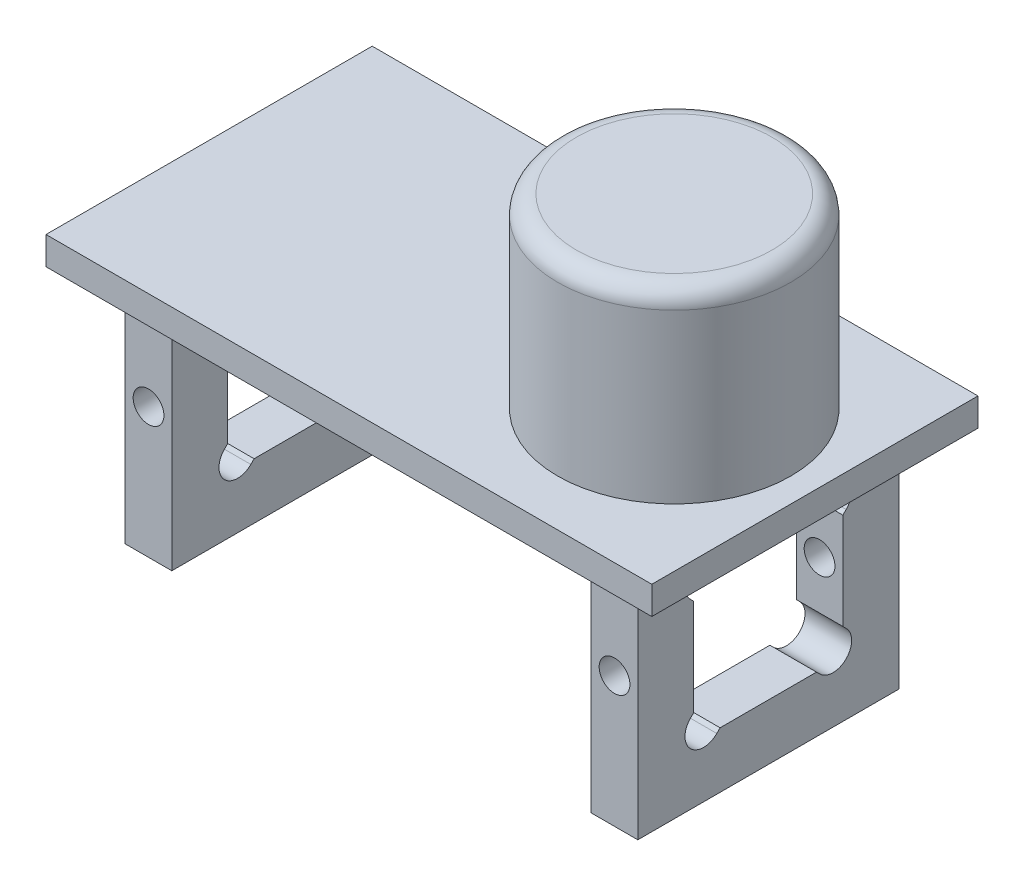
SolidWorks part; units mm, degrees
ref_plane "Plan de face" through (0, 0, 0) normal (0, 0, 1) x (1, 0, 0)
ref_plane "Plan de dessus" through (0, 0, 0) normal (0, 1, 0) x (1, 0, 0)
ref_plane "Plan de droite" through (0, 0, 0) normal (1, 0, 0) x (0, 0, -1)
sketch "Esquisse1" plane through (0, 0, 0) normal (0, 0, 1) x (1, 0, 0)
  line L1 (0, 0) -> (65, 0)
  line L2 (0, 0) -> (0, 3)
  line L3 (0, 3) -> (65, 3)
  line L4 (65, 0) -> (65, 3)
  dimension "D1" = 65
  dimension "D2" = 3
extrude "Boss.-Extru.1" add sketch "Esquisse1" along normal mid plane 35
sketch "Esquisse2" plane through (0, 3, 0) normal (0, 1, 0) x (1, 0, 0)
  circle A0 centre (49.9073, 0) radius 12.5
  dimension "D1" = 25
extrude "Boss.-Extru.2" add sketch "Esquisse2" along normal blind 20
sketch "Esquisse4" plane through (0, 0, 0) normal (-1, 0, 0) x (0, 0, 1)
  line L0 (17.5, 0) -> (-17.5, 0) construction
  line L1 (-8, -3) -> (8, -3) construction
  line L2 (-8, -3) -> (-8, -19) construction
  line L3 (-8, -19) -> (8, -19) construction
  line L4 (8, -3) -> (8, -19) construction
  line L6 (-14, 0) -> (14, 0)
  line L7 (-14, 0) -> (-14, -25)
  line L8 (-14, -25) -> (14, -25)
  line L9 (14, 0) -> (14, -25)
  line L10 (-8, -3) -> (8, -3)
  line L11 (-8, -3) -> (-8, -19)
  line L12 (-8, -19) -> (8, -19)
  line L13 (8, -3) -> (8, -19)
  dimension "D1" = 16
  dimension "D2" = 8
  dimension "D3" = 3
  dimension "D4" = 6
  dimension "D5" = 6
  dimension "D6" = 6
extrude "Boss.-Extru.3" add sketch "Esquisse4" against normal blind 5 from offset 5
pattern_linear "Répétition linéaire1" count 2 spacing 50 along (1, 0, 0) of "Boss.-Extru.3"
fillet "Congé1" radius 2 1 edges at (49.9073, 23, 12.5)
sketch "Esquisse5" plane through (60, 0, 0) normal (1, 0, 0) x (0, 0, -1)
  line L0 (8, -19) -> (-8, -3) construction
  line L1 (-5.5251, -2.6464) -> (-9.2387, -6.36) construction
  line L2 (-5.5251, -2.6464) -> (-5.1716, -3)
  line L3 (-8, -3) -> (8, -3) construction
  line L4 (-8.3536, -5.4749) -> (-8, -5.8284)
  line L5 (-8, -19) -> (-8, -3) construction
  line L6 (-8, -5.8284) -> (-5.1716, -3)
  line L7 (8.3536, -5.4749) -> (8, -5.8284)
  line L8 (5.5251, -2.6464) -> (5.1716, -3)
  line L9 (5.1716, -3) -> (8, -5.8284)
  line L10 (-8, -19) -> (8, -3) construction
  line L11 (8.3536, -5.4749) -> (4.64, -1.7613) construction
  line L12 (5.5251, -19.3536) -> (5.1716, -19)
  line L13 (8.3536, -16.5251) -> (8, -16.1716)
  line L14 (8, -16.1716) -> (5.1716, -19)
  line L15 (-8, -3) -> (8, -19) construction
  line L16 (5.5251, -19.3536) -> (9.2387, -15.64) construction
  line L17 (-8.3536, -16.5251) -> (-8, -16.1716)
  line L18 (-5.5251, -19.3536) -> (-5.1716, -19)
  line L19 (-5.1716, -19) -> (-8, -16.1716)
  line L20 (8, -3) -> (-8, -19) construction
  line L21 (-8.3536, -16.5251) -> (-4.64, -20.2387) construction
  arc A0 (-5.5251, -2.6464) -> (-8.3536, -5.4749) centre (-6.9393, -4.0607) ccw
  arc A1 (8.3536, -5.4749) -> (5.5251, -2.6464) centre (6.9393, -4.0607) ccw
  arc A2 (5.5251, -19.3536) -> (8.3536, -16.5251) centre (6.9393, -17.9393) ccw
  arc A3 (-8.3536, -16.5251) -> (-5.5251, -19.3536) centre (-6.9393, -17.9393) ccw
  point P1 (0, -11)
  dimension "D1" = 4
  dimension "D2" = 1.5
  dimension "D3" = 4
extrude "Enlèv. mat.-Extru.1" cut sketch "Esquisse5" against normal through all
hole_wizard "Trou taraudé M41" positions "Esquisse9" profile "Esquisse8" tap size "M4" standard "ISO"
sketch "Esquisse9" plane through (0, 0, 14) normal (0, 0, 1) x (1, 0, 0)
  line L1 (10, -25) -> (10, 0) construction
  line L2 (60, -25) -> (60, 0) construction
  point P0 (57.5, -11)
  point P1 (7.5, -11)
  dimension "D2" = 2.5
  dimension "D3" = 2.5
sketch "Esquisse8" plane through (57.5, -11, 14) normal (1, 0, 0) x (0, -1, 0)
  line L0 (0, 0) -> (0, 31.5)
  line L1 (0, 31.5) -> (1.65, 31.5)
  line L2 (1.65, 31.5) -> (1.65, 0)
  line L5 (1.65, 0) -> (0, 0)
  line L11 (0, -6.35) -> (0, 107.95) construction
  dimension "Diamètre du trou pour taraudage jusqu'au prochain" = 3.3
  dimension "Profondeur du trou pour taraudage jusqu'au prochain" = 31.5
